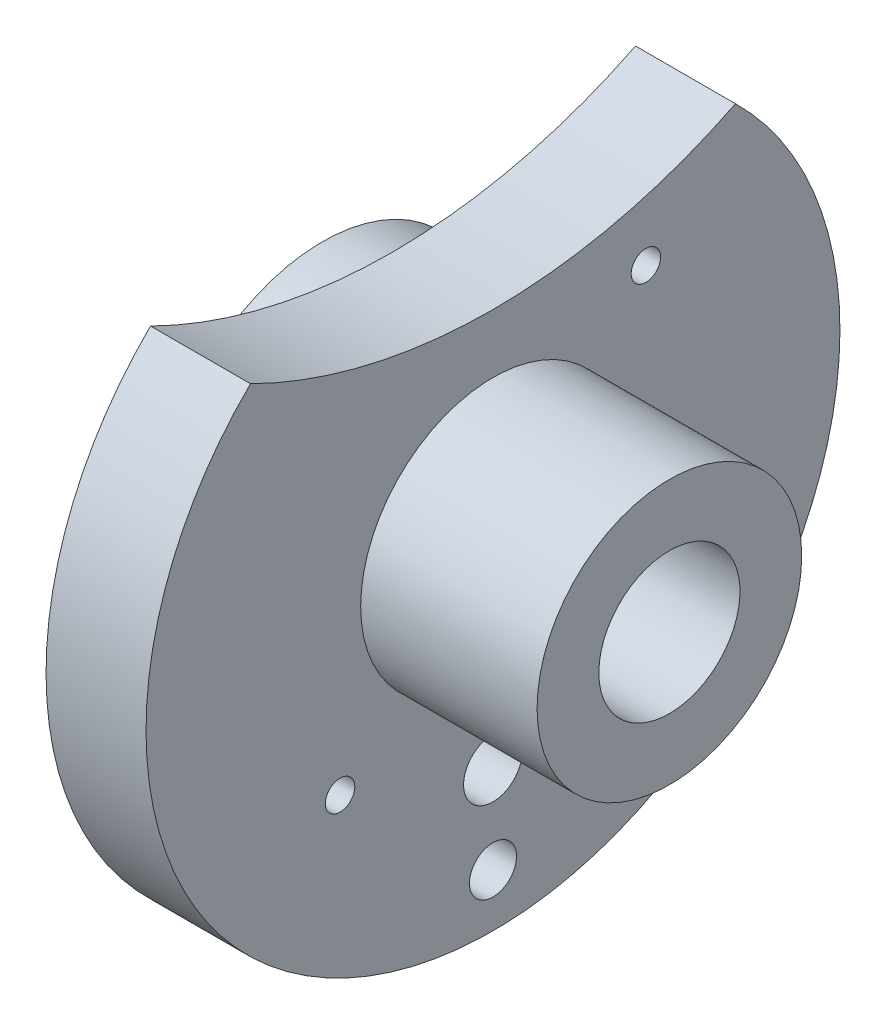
SolidWorks part; units mm, degrees
ref_plane "Plan1" through (0, 0, 0) normal (0, 0, 1) x (1, 0, 0)
ref_plane "Plan2" through (0, 0, 0) normal (0, 1, 0) x (1, 0, 0)
ref_plane "Plan3" through (0, 0, 0) normal (1, 0, 0) x (0, 0, -1)
sketch "Esquisse1" plane through (0, 0, 0) normal (0, 0, 1) x (1, 0, 0)
  line L0 (-50, 0) -> (100, 0) construction
  line L1 (0, 24) -> (0, 28)
  line L2 (0, 28) -> (12, 28)
  line L3 (12, 28) -> (12, 59)
  line L4 (12, 59) -> (29, 59)
  line L5 (29, 59) -> (29, 22.5)
  line L6 (29, 22.5) -> (59, 22.5)
  line L7 (59, 22.5) -> (59, 12)
  line L8 (59, 12) -> (19, 12)
  line L9 (19, 12) -> (19, 24)
  line L10 (19, 24) -> (0, 24)
  dimension "D1" = 22.5
  dimension "D2" = 59
  dimension "D3" = 28
  dimension "D4" = 24
  dimension "D5" = 12
  dimension "D6" = 12
  dimension "D7" = 19
  dimension "D8" = 17
  dimension "D9" = 40
revolve "Base-Révolution" add sketch "Esquisse1" angle 360 about L0
sketch "Esquisse2" plane through (12, 0, 0) normal (-1, 0, 0) x (0, 0, 1)
  circle A0 centre (0, 125) radius 92.5
  circle A1 centre (0, 0) radius 59 construction
  dimension "D1" = 185
  dimension "D2" = 125
extrude "Enlèv. mat.-Extru.1" cut sketch "Esquisse2" against normal through all
sketch "Esquisse6" plane through (12, 0, 0) normal (-1, 0, 0) x (0, 0, 1)
  circle A0 centre (0, -35) radius 5
  circle A1 centre (0, -50) radius 4
  circle A2 centre (0, 0) radius 12 construction
  dimension "D1" = 8
  dimension "D2" = 10
  dimension "D3" = 35
  dimension "D4" = 50
extrude "Enlèv. mat.-Extru.2" cut sketch "Esquisse6" against normal through all
sketch "Esquisse7" plane through (12, 0, 0) normal (-1, 0, 0) x (0, 0, 1)
  circle A0 centre (-26, 26) radius 2.5
  circle A1 centre (26, -26) radius 2.5
  circle A2 centre (0, 0) radius 12 construction
  dimension "D1" = 5
  dimension "D2" = 5
  dimension "D3" = 26
  dimension "D4" = 26
  dimension "D5" = 26
  dimension "D6" = 26
extrude "Enlèv. mat.-Extru.3" cut sketch "Esquisse7" against normal through all
